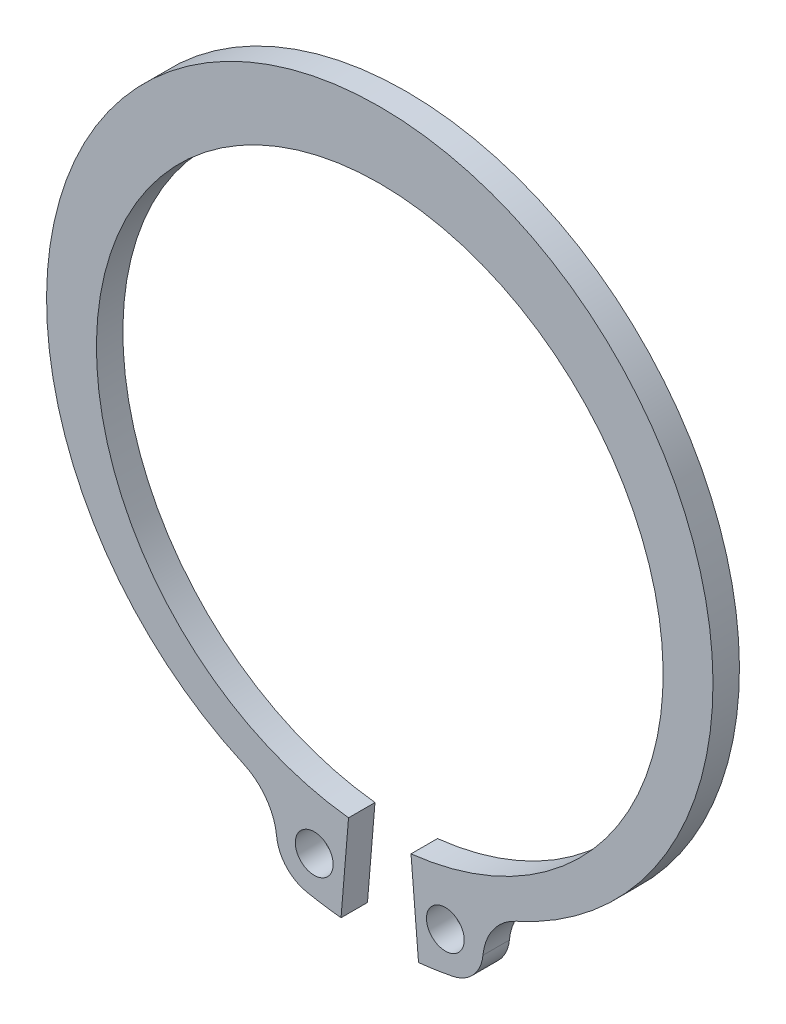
SolidWorks part; units mm, degrees
ref_plane "Face" through (0, 0, 0) normal (0, 0, 1) x (1, 0, 0)
ref_plane "Dessus" through (0, 0, 0) normal (0, 1, 0) x (1, 0, 0)
ref_plane "Droite" through (0, 0, 0) normal (1, 0, 0) x (0, 0, -1)
sketch "Esquisse1" plane through (0, 0, 0) normal (0, 0, 1) x (1, 0, 0)
  line L0 (0, 23.15) -> (0, 18.75) construction
  line L1 (2.0667, -18.6358) -> (2.5643, -24.6151)
  line L2 (-2.0667, -18.6358) -> (-2.5643, -24.6151)
  line L3 (0.5, -18.2431) -> (0.5, -24.2431) construction
  line L4 (-0.5, -18.2431) -> (-0.5, -24.2431) construction
  arc A0 (2.0667, -18.6358) -> (-2.0667, -18.6358) centre (0, 0) ccw
  arc A1 (9.0233, -19.0192) -> (-9.0233, -19.0192) centre (0, 1.1) ccw
  arc A2 (2.5643, -24.6151) -> (4.8262, -24.2731) centre (0, 0) ccw
  circle A3 centre (4.3387, -21.8211) radius 1.25
  arc A4 (4.8262, -24.2731) -> (6.8264, -22.069) centre (4.3387, -21.8211) ccw
  arc A5 (9.0233, -19.0192) -> (6.8264, -22.069) centre (10.5579, -22.4408) ccw
  circle A6 centre (-4.3387, -21.8211) radius 1.25
  arc A7 (-9.0233, -19.0192) -> (-6.8264, -22.069) centre (-10.5579, -22.4408) cw
  arc A8 (-4.8262, -24.2731) -> (-6.8264, -22.069) centre (-4.3387, -21.8211) cw
  arc A9 (-2.5643, -24.6151) -> (-4.8262, -24.2731) centre (0, 0) cw
  arc A10 (0.5, -18.2431) -> (-0.5, -18.2431) centre (0, 0) ccw construction
  circle A11 centre (0, 0) radius 20 construction
  dimension "dgorge" = 37.5
  dimension "D3" = 1.1
  dimension "dtrou" = 2.5
  dimension "D8" = 2.5
  dimension "D9" = 3.75
  dimension "dint" = 36.5
  dimension "dn" = 40
  dimension "b" = 4.4
  dimension "a" = 6
  dimension "D5" = 12.656
  dimension "D7" = 2
  dimension "D12" = 1
  dimension "D13" = 3.14
  dimension "D14" = 4.758
extrude "Base-Extrusion" add sketch "Esquisse1" along normal blind 1.75
equation "\"D3@Esquisse1\" = \"b@Esquisse1\"/4"
equation "\"D7@Esquisse1\"=\"dtrou@Esquisse1\"*0.8"
equation "\"D8@Esquisse1\" = \"dtrou@Esquisse1\""
equation "\"D9@Esquisse1\" = \"dtrou@Esquisse1\"*1.5"
equation "\"D12@Esquisse1\" = \"dtrou@Esquisse1\"*0.4"
equation "\"D5@Esquisse1\" = 360-(360-\"D13@Esquisse1\")*\"dint@Esquisse1\"/\"dgorge@Esquisse1\""
equation "\"D14@Esquisse1\" = (\"D5@Esquisse1\"-\"D13@Esquisse1\")/2"
